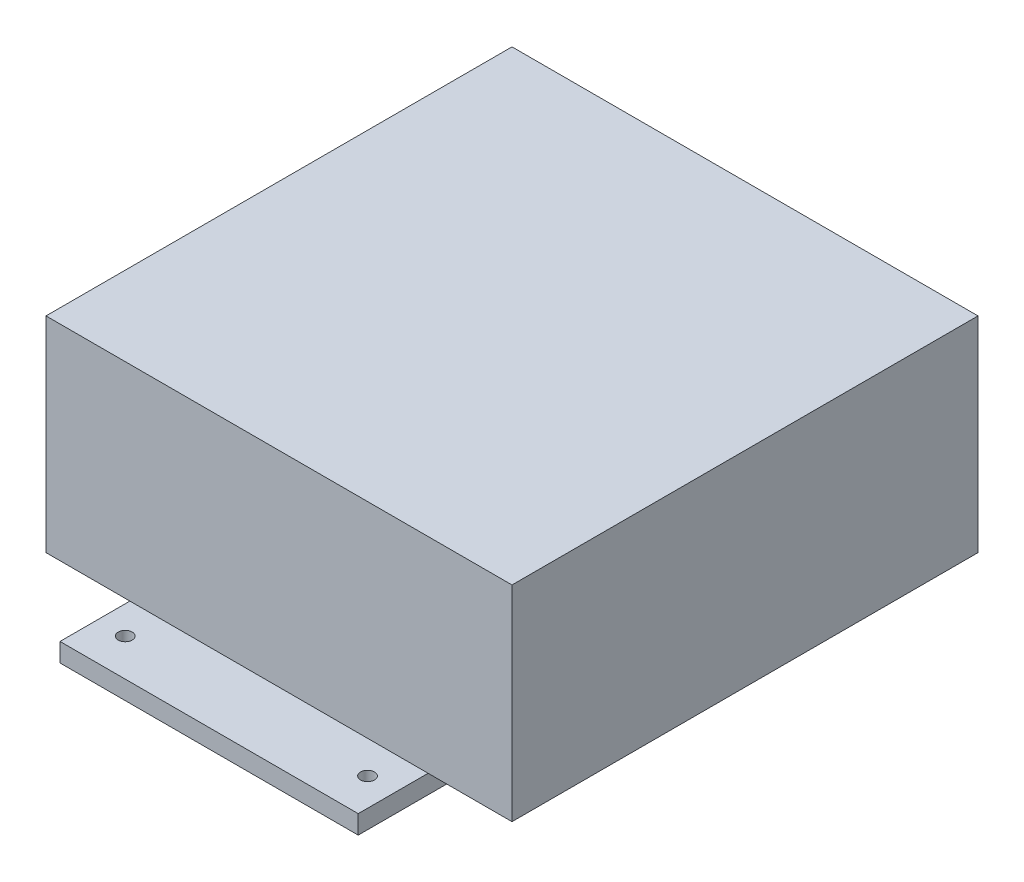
SolidWorks part; units mm, degrees
ref_plane "Спереди" through (0, 0, 0) normal (0, 0, 1) x (1, 0, 0)
ref_plane "Сверху" through (0, 0, 0) normal (0, 1, 0) x (1, 0, 0)
ref_plane "Справа" through (0, 0, 0) normal (1, 0, 0) x (0, 0, -1)
sketch "Эскиз1" plane through (0, 0, 0) normal (0, 1, 0) x (1, 0, 0)
  line L0 (-16, 0) -> (16, 0) construction
  line L1 (-16, 32.5) -> (16, 32.5)
  line L2 (-16, 32.5) -> (-16, -32.5)
  line L3 (-16, -32.5) -> (16, -32.5)
  line L4 (16, 32.5) -> (16, -32.5)
  line L5 (-16, 32.5) -> (16, -32.5) construction
  line L6 (-16, -32.5) -> (16, 32.5) construction
  line L8 (0, 32.5) -> (0, -32.5) construction
  circle A4 centre (-13, 28.5) radius 0.75
  circle A5 centre (13, 28.5) radius 0.75
  circle A6 centre (13, -28.5) radius 0.75
  circle A7 centre (-13, -28.5) radius 0.75
  point P12 (0, 0)
  dimension "D4" = 1.5
  dimension "D2" = 57
  dimension "D3" = 26
  dimension "D5" = 32
  dimension "D6" = 65
extrude "Бобышка-Вытянуть1" add sketch "Эскиз1" along normal blind 2
sketch "Эскиз2" plane through (0, 2, 0) normal (0, 1, 0) x (1, 0, 0)
  line L1 (-25, 25) -> (25, 25)
  line L2 (-25, 25) -> (-25, -25)
  line L3 (-25, -25) -> (25, -25)
  line L4 (25, 25) -> (25, -25)
  line L5 (-25, 25) -> (25, -25) construction
  line L6 (-25, -25) -> (25, 25) construction
  point P0 (0, 0)
  dimension "D1" = 50
extrude "Бобышка-Вытянуть2" add sketch "Эскиз2" along normal blind 22
